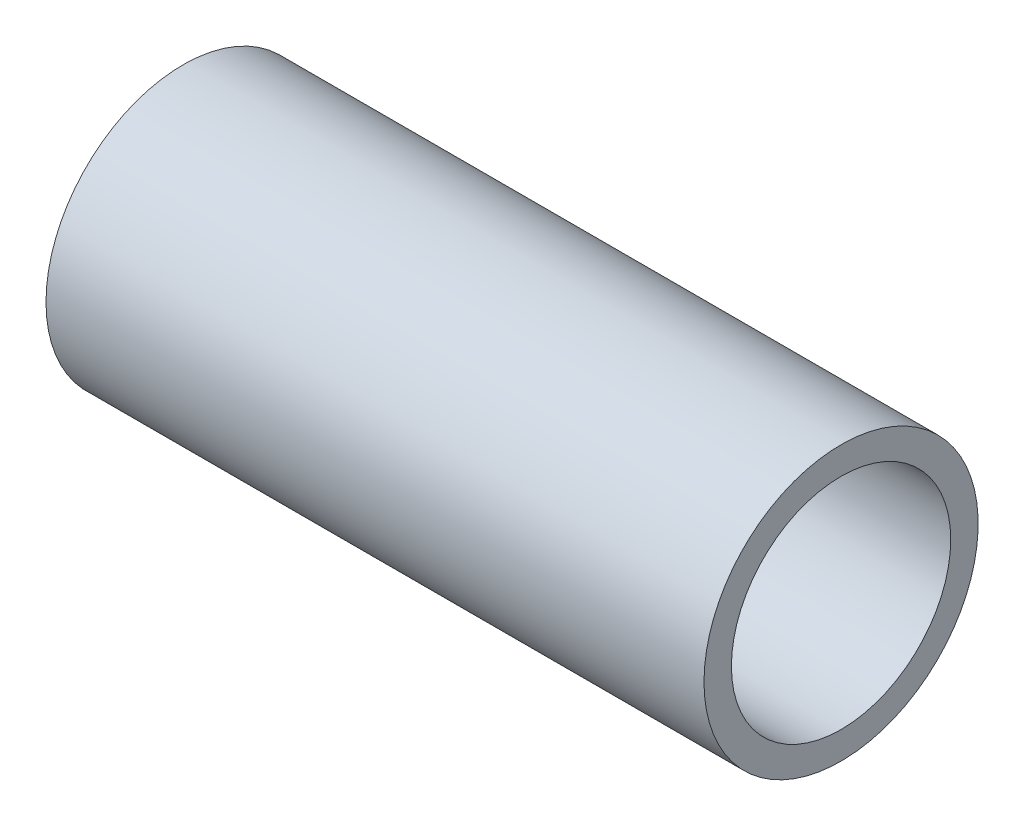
SolidWorks part; units mm, degrees
ref_plane "Front" through (0, 0, 0) normal (0, 0, 1) x (1, 0, 0)
ref_plane "Top" through (0, 0, 0) normal (0, 1, 0) x (1, 0, 0)
ref_plane "Right" through (0, 0, 0) normal (1, 0, 0) x (0, 0, -1)
sketch "Sketch1" plane through (0, 0, 0) normal (1, 0, 0) x (0, 0, -1)
  circle A0 centre (0, 0) radius 12.7
  circle A1 centre (0, 0) radius 15.875
  dimension "D1" = 25.4
  dimension "D2" = 31.75
extrude "Base-Extrude" add sketch "Sketch1" along normal blind 76.2
